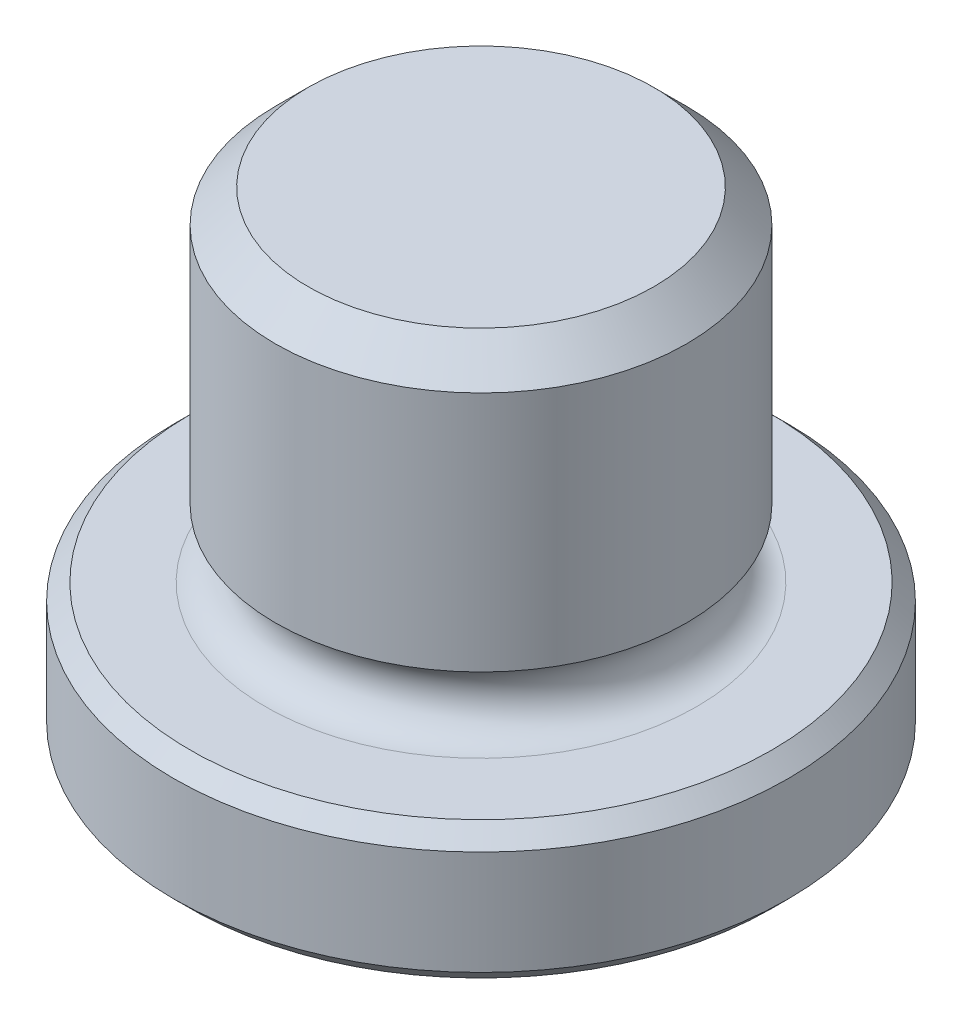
SolidWorks part; units mm, degrees
ref_plane "Front Plane" through (0, 0, 0) normal (0, 0, 1) x (1, 0, 0)
ref_plane "Top Plane" through (0, 0, 0) normal (0, 1, 0) x (1, 0, 0)
ref_plane "Right Plane" through (0, 0, 0) normal (1, 0, 0) x (0, 0, -1)
sketch "Sketch1" plane through (0, 0, 0) normal (0, 0, 1) x (1, 0, 0)
  line L0 (0, 0) -> (6.731, 0)
  line L1 (7.112, 0.381) -> (7.112, 2.794)
  line L2 (6.731, 3.175) -> (5.3835, 3.175)
  line L3 (4.7625, 4.7432) -> (4.7625, 10.3378)
  line L4 (4.0005, 11.0998) -> (0, 11.0998)
  line L5 (0, 11.0998) -> (0, 0)
  line L6 (0, -6.1161) -> (0, 6.1161) construction
  line L7 (7.8232, 0) -> (-7.8232, 0) construction
  line L8 (6.731, 0) -> (7.112, 0.381)
  line L9 (7.112, 2.794) -> (6.731, 3.175)
  line L10 (4.7625, 10.3378) -> (4.0005, 11.0998)
  line L11 (5.3835, 3.175) -> (4.991, 3.175)
  line L12 (4.7174, 4.7268) -> (4.7625, 4.7432)
  arc A1 (4.991, 3.175) -> (4.7174, 4.7268) centre (4.991, 3.975) cw
  point P1 (7.112, 0)
  point P3 (7.112, 3.175)
  point P6 (4.7625, 11.0998)
  dimension "D5" = 1.5682
  dimension "D6" = 0.8
  dimension "D7" = 4.191
  dimension "D1" = 7.112
  dimension "D2" = 11.0998
  dimension "D3" = 3.175
  dimension "D4" = 4.7625
  dimension "D11" = 20
revolve "Revolve1" add sketch "Sketch1" angle 360 about L5
sketch "Sketch2" plane through (0, 0, 0) normal (0, -1, 0) x (1, 0, 0)
  line L1 (-1.3748, 2.3813) -> (-2.7496, 0)
  line L2 (-2.7496, 0) -> (-1.3748, -2.3812)
  line L3 (-1.3748, -2.3812) -> (1.3748, -2.3812)
  line L4 (1.3748, -2.3812) -> (2.7496, 0)
  line L5 (2.7496, 0) -> (1.3748, 2.3813)
  line L6 (1.3748, 2.3813) -> (-1.3748, 2.3813)
  circle A0 centre (0, 0) radius 2.3812 construction
  dimension "D1" = 4.7625
extrude "Cut-Extrude1" cut sketch "Sketch2" against normal blind 7.874
sketch "Sketch8" plane through (0, 0, 0) normal (0, 0, 1) x (1, 0, 0)
  line L0 (-3.0036, 0) -> (-1.4796, 1.524)
  line L1 (-6.731, 0) -> (6.731, 0) construction
  line L3 (-1.4796, 1.524) -> (0, 1.524)
  line L4 (0, 1.524) -> (0, 0)
  line L5 (0, 0) -> (-3.0036, 0)
  line L7 (-2.7496, 7.874) -> (-2.7496, 0) construction
  line L8 (0, 1.524) -> (0, -0.942) construction
  dimension "D1" = 45
  dimension "D2" = 0.254
  dimension "D3" = 1.524
revolve "Cut-Revolve1" cut sketch "Sketch8" angle 360 about L8
thread "Thread1" pitch 1.27 start angle 0, offset 1.524, length 7.112, pitch 1.27, diameter 9.525
ref_plane "Plane1" through (-4.7625, 11.8618, 0) normal (0, 0, 1) x (-1, 0, 0)
sketch "Thread Profile1" plane through (-4.7625, 11.8618, 0) normal (0, 0, 1) x (-1, 0, 0)
  line L0 (0, 0) -> (0, 1.27) construction
  line L11 (0, 0) -> (0, 1.1112)
  line L12 (0, 1.1112) -> (-0.6874, 0.7144)
  line L13 (-0.6874, 0.7144) -> (-0.6874, 0.3969)
  line L15 (-0.6874, 0.3969) -> (0, 0)
  line L17 (-0.6874, 0.5556) -> (0, 0.5556) construction
  point P2 (0, 0)
  dimension "Pitch" = 1.27
  dimension "Profile_Angle" = 60
  dimension "Profile_Land" = 0.3175
  dimension "Profile_Height" = 0.6874
